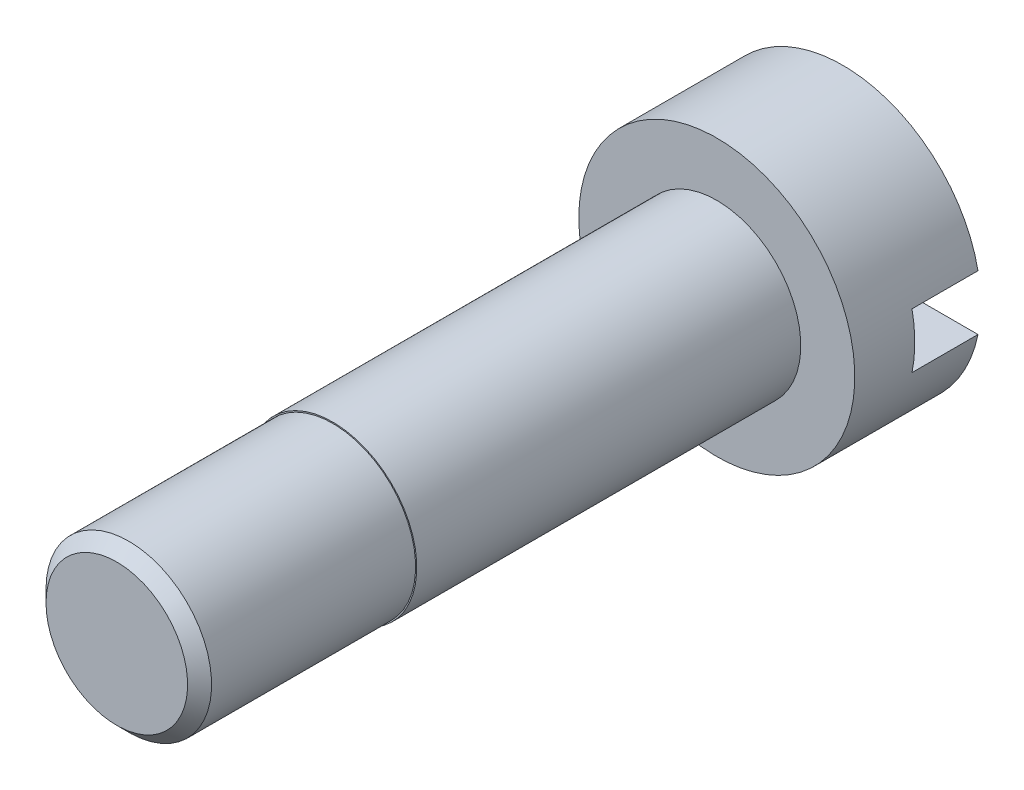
SolidWorks part; units mm, degrees
ref_plane "Спереди" through (0, 0, 0) normal (0, 0, 1) x (1, 0, 0)
ref_plane "Сверху" through (0, 0, 0) normal (0, 1, 0) x (1, 0, 0)
ref_plane "Справа" through (0, 0, 0) normal (1, 0, 0) x (0, 0, -1)
sketch "Эскиз1" plane through (0, 0, 0) normal (1, 0, 0) x (0, 0, -1)
  line L0 (0, 0) -> (-27.5713, 0) construction
  line L1 (0, 0) -> (0, 2.921)
  line L2 (0, 2.921) -> (-2.667, 2.921)
  line L3 (-2.667, 2.921) -> (-2.667, 1.778)
  line L4 (-2.667, 1.778) -> (-10.795, 1.778)
  line L5 (-10.795, 1.778) -> (-10.795, 1.7526)
  line L6 (-10.795, 1.7526) -> (-15.113, 1.7526)
  line L7 (-15.367, 1.4986) -> (-15.367, 0)
  line L8 (-15.367, 0) -> (0, 0)
  line L9 (-15.113, 1.7526) -> (-15.367, 1.4986)
  point P9 (-15.367, 1.7526)
  dimension "D1" = 5.842
  dimension "D2" = 3.556
  dimension "D3" = 3.5052
  dimension "D4" = 2.667
  dimension "D5" = 12.7
  dimension "D6" = 8.128
revolve "Повернуть1" add sketch "Эскиз1" angle 360 about L0
sketch "Эскиз2" plane through (0, 0, 0) normal (1, 0, 0) x (0, 0, -1)
  line L1 (0, 0.5842) -> (-1.397, 0.5842)
  line L2 (0, 0.5842) -> (0, -0.5842)
  line L3 (0, -0.5842) -> (-1.397, -0.5842)
  line L4 (-1.397, 0.5842) -> (-1.397, -0.5842)
  dimension "D1" = 1.1684
  dimension "D2" = 1.397
extrude "Вырез-Вытянуть1" cut sketch "Эскиз2" against normal mid plane 7.62
